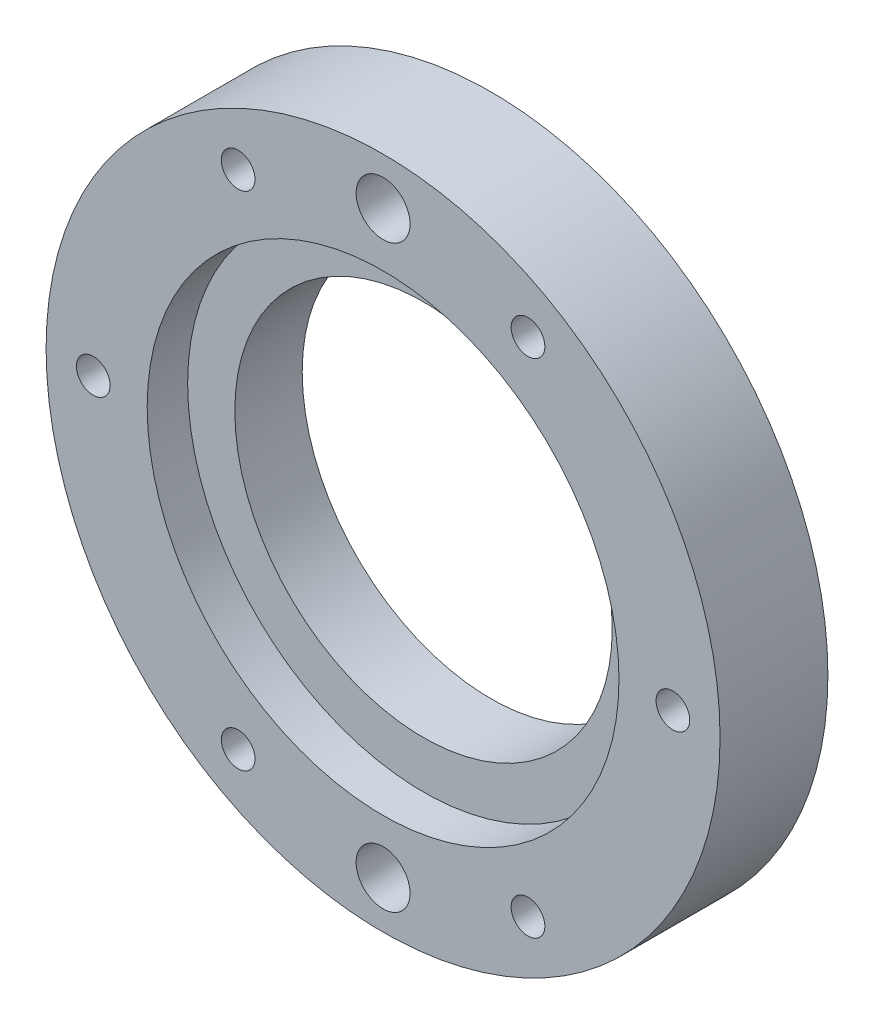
SolidWorks part; units mm, degrees
ref_plane "正面" through (0, 0, 0) normal (0, 0, 1) x (1, 0, 0)
ref_plane "平面" through (0, 0, 0) normal (0, 1, 0) x (1, 0, 0)
ref_plane "右側面" through (0, 0, 0) normal (1, 0, 0) x (0, 0, -1)
sketch "ｽｹｯﾁ1" plane through (0, 0, 0) normal (0, 0, 1) x (1, 0, 0)
  line L0 (-45.5869, 0) -> (39.9498, 0) construction
  line L1 (0, 32.7197) -> (0, -38.1117) construction
  circle A0 centre (0, 0) radius 25
  circle A1 centre (0, 0) radius 17.5
  circle A2 centre (0, 0) radius 21.5 construction
  circle A3 centre (0, 21.5) radius 2
  circle A4 centre (0, -21.5) radius 2
  circle A5 centre (0, 0) radius 14
  point P13 (21.5, 0)
  point P14 (10.75, -18.6195)
  point P15 (-10.75, -18.6195)
  point P18 (-21.5, 0)
  point P19 (-10.75, 18.6195)
  point P20 (10.75, 18.6195)
  point P21 (0, 0)
  dimension "D1" = 35
  dimension "D2" = 50
  dimension "D3" = 43
  dimension "D4" = 4
  dimension "D6" = 28
  dimension "D5" = 6
sketch "ｽｹｯﾁ2" plane through (0, 0, 0) normal (0, 0, 1) x (1, 0, 0)
  circle A0 centre (0, 0) radius 25 construction
  circle A1 centre (0, 0) radius 17.5 construction
  circle A2 centre (0, 0) radius 25
  circle A3 centre (0, 0) radius 17.5
extrude "ﾎﾞｽ - 押し出し1" add sketch "ｽｹｯﾁ2" along normal blind 8
sketch "ｽｹｯﾁ3" plane through (0, 0, 8) normal (0, 0, 1) x (1, 0, 0)
  circle A0 centre (0, -21.5) radius 2 construction
  circle A1 centre (0, 21.5) radius 2 construction
  circle A2 centre (0, -21.5) radius 2
  circle A3 centre (0, 21.5) radius 2
extrude "ｶｯﾄ - 押し出し1" cut sketch "ｽｹｯﾁ3" against normal blind 6
hole_wizard "M3x0.5 ねじ穴1" positions "ｽｹｯﾁ4" profile "ｽｹｯﾁ5" tap size "M3x0.5" standard "JIS"
sketch "ｽｹｯﾁ4" plane through (0, 0, 8) normal (0, 0, 1) x (1, 0, 0)
  point P0 (-10.75, 18.6195)
  point P3 (10.75, 18.6195)
  point P6 (21.5, 0)
  point P9 (10.75, -18.6195)
  point P12 (-10.75, -18.6195)
  point P15 (-21.5, 0)
sketch "ｽｹｯﾁ5" plane through (-10.75, 18.6195, 8) normal (1, 0, 0) x (0, -1, 0)
  line L0 (0, 0) -> (0, 9.2511)
  line L1 (0, 9.2511) -> (1.25, 8.5)
  line L2 (1.25, 8.5) -> (1.25, 0)
  line L5 (1.25, 0) -> (0, 0)
  line L10 (0, 9.2511) -> (-1.25, 8.5) construction
  line L11 (0, -6.35) -> (0, 107.95) construction
  dimension "ねじ下穴ﾄﾞﾘﾙ直径" = 2.5
  dimension "ねじ下穴ﾄﾞﾘﾙの深さ" = 8.5
  dimension "ﾄﾞﾘﾙ角度" = 118
sketch "ｽｹｯﾁ6" plane through (0, 0, 0) normal (0, 0, 1) x (1, 0, 0)
  circle A0 centre (0, 0) radius 17.5 construction
  circle A1 centre (0, 0) radius 14 construction
  circle A2 centre (0, 0) radius 17.5
  circle A3 centre (0, 0) radius 14
extrude "ﾎﾞｽ - 押し出し2" add sketch "ｽｹｯﾁ6" along normal blind 5
